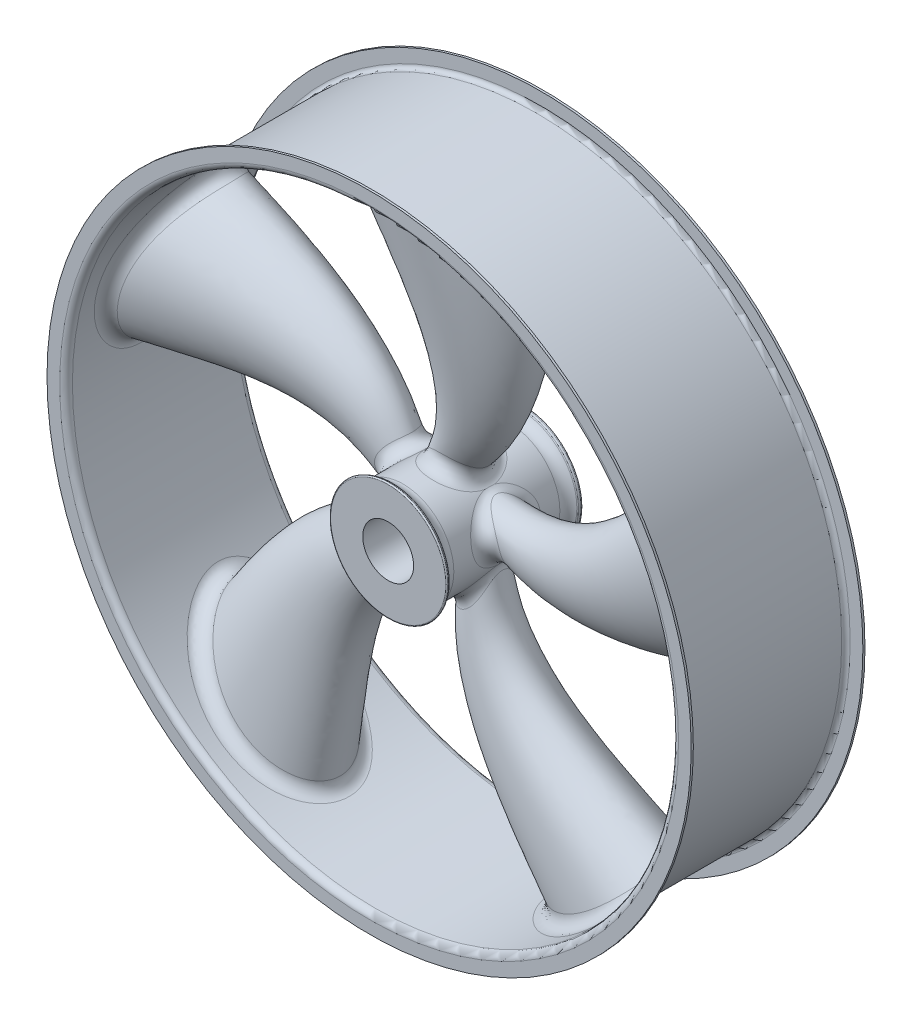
SolidWorks part; units mm, degrees
ref_plane "Front Plane" through (0, 0, 0) normal (0, 0, 1) x (1, 0, 0)
ref_plane "Top Plane" through (0, 0, 0) normal (0, 1, 0) x (1, 0, 0)
ref_plane "Right Plane" through (0, 0, 0) normal (1, 0, 0) x (0, 0, -1)
sketch "Sketch1" plane through (0, 0, 0) normal (0, 1, 0) x (1, 0, 0)
  line L0 (38.1, -101.6) -> (38.1, 101.6)
  line L1 (38.1, 101.6) -> (86.2887, 101.6)
  line L2 (87.7145, 99.2733) -> (86.5478, 96.9836)
  line L3 (83.7189, 95.25) -> (76.2, 95.25)
  line L4 (76.2, 95.25) -> (76.2, -95.25)
  line L5 (38.1, 0) -> (62.5327, 0) construction
  line L6 (0, 0) -> (0, 86.8048) construction
  line L7 (83.7189, -95.25) -> (76.2, -95.25)
  line L8 (87.7145, -99.2733) -> (86.5478, -96.9836)
  line L9 (38.1, -101.6) -> (86.2887, -101.6)
  arc A0 (86.5478, 96.9836) -> (83.7189, 95.25) centre (83.7189, 98.425) cw
  arc A1 (83.7189, -95.25) -> (86.5478, -96.9836) centre (83.7189, -98.425) cw
  arc A2 (87.7145, -99.2733) -> (86.2887, -101.6) centre (86.2887, -99.9998) cw
  arc A3 (86.2887, 101.6) -> (87.7145, 99.2733) centre (86.2887, 99.9998) cw
  point P13 (85.6645, 95.25)
  point P16 (85.6645, -95.25)
  point P19 (88.9, -101.6)
  point P22 (88.9, 101.6)
  dimension "D7" = 3.175
  dimension "D8" = 1.6002
  dimension "D1" = 203.2
  dimension "D2" = 6.35
  dimension "D3" = 38.1
  dimension "D4" = 12.7
  dimension "D5" = 50.8
  dimension "D6" = 63
revolve "Revolve1" add sketch "Sketch1" angle 360 about L6
sketch "Sketch2" plane through (0, 0, 0) normal (0, 1, 0) x (1, 0, 0)
  line L0 (0, 0) -> (1501.5504, 0) construction
  line L1 (457.2, -120.65) -> (457.2, 120.65)
  line L3 (463.55, 127) -> (482.6, 127)
  line L4 (463.55, -127) -> (482.6, -127)
  line L6 (0, 0) -> (0, 288.9035) construction
  arc A0 (457.2, 120.65) -> (463.55, 127) centre (463.55, 120.65) cw
  arc A1 (463.55, -127) -> (457.2, -120.65) centre (463.55, -120.65) cw
  point P9 (457.2, 127)
  point P10 (457.2, 0)
  point P14 (457.2, -127)
  dimension "D4" = 6.35
  dimension "D1" = 457.2
  dimension "D2" = 254
  dimension "D3" = 25.4
revolve "Revolve-Thin1" add sketch "Sketch2" angle 360 about L6
sketch "Sketch3" plane through (0, 0, 0) normal (0, 1, 0) x (1, 0, 0)
  ellipse E0 centre (0, 0) end of major axis (34.71, 0) minor radius 29.1921
  ellipse E1 centre (0, 0) end of major axis (121.9399, 30.7599) minor radius 78.9249 construction
sketch "Sketch5" plane through (0, 0, 0) normal (0, 1, 0) x (1, 0, 0)
  ellipse E0 centre (0, 0) end of major axis (121.9399, 30.7599) minor radius 78.9249 construction
  ellipse E1 centre (0, 0) end of major axis (121.9399, 30.7599) minor radius 78.9249
sketch "Sketch4" plane through (0, 0, 0) normal (0, 0, 1) x (1, 0, 0)
  circle A1 centre (0, 0) radius 454.025 construction
  circle A4 centre (0, 0) radius 76.2 construction
  spline S0 degree 3 poles (0, 76.2) (79.7452, 189.0267) (35.9346, 323.1778) (0, 454.025) knots 0 0 0 0 1 1 1 1
loft "Loft1" add
pattern_circular "CirPattern4" count 5 over 360 about axis through (0, 0, 0) along (0, 0, 1) of "Loft1"
fillet "Fillet1" radius 19.05 14 edges at (83.7189, 0, 95.25) (76.2, 0, 95.25) (76.2, 0, -95.25) (83.7189, 0, -95.25)
